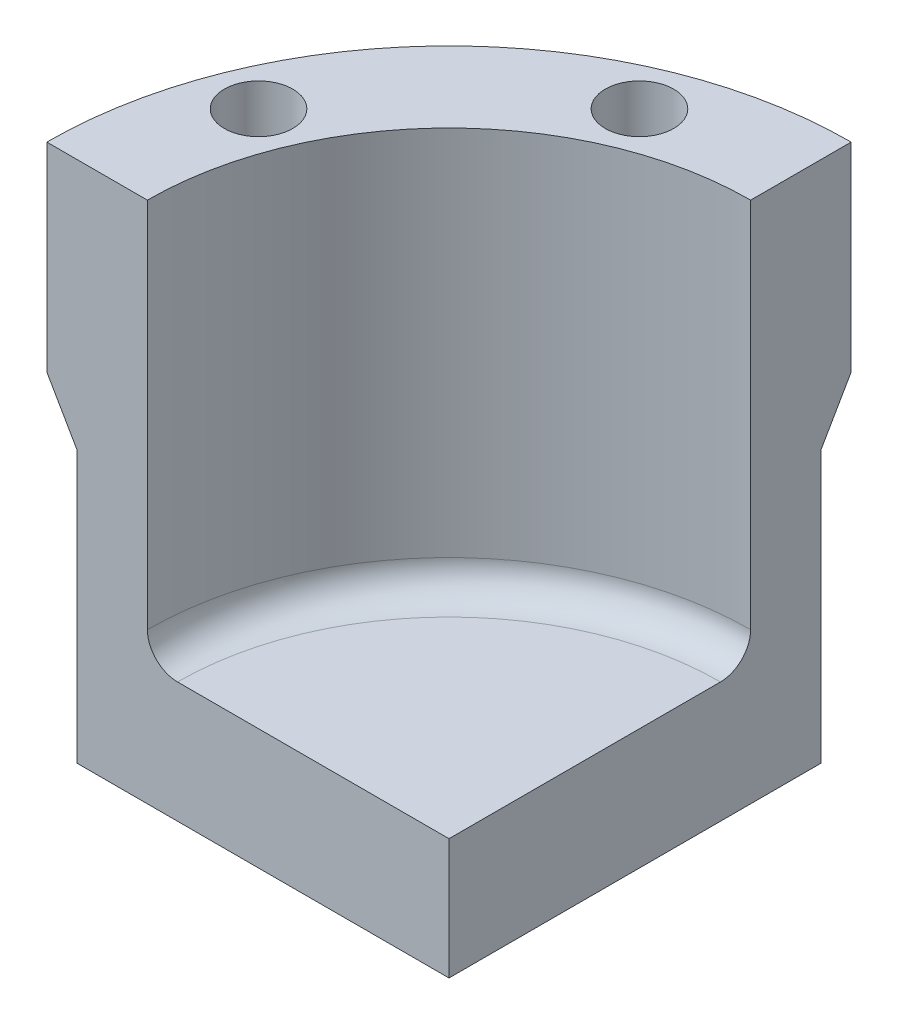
SolidWorks part; units mm, degrees
ref_plane "Ebene vorne" through (0, 0, 0) normal (0, 0, 1) x (1, 0, 0)
ref_plane "Ebene oben" through (0, 0, 0) normal (0, 1, 0) x (1, 0, 0)
ref_plane "Ebene rechts" through (0, 0, 0) normal (1, 0, 0) x (0, 0, -1)
sketch "Skizze1" plane through (0, 0, 0) normal (0, 0, 1) x (1, 0, 0)
  line L0 (0, 0) -> (-30, 0)
  line L1 (55, 0) -> (-55, 0) construction
  line L2 (-30, 0) -> (-30, 40)
  line L3 (-30, 40) -> (-40, 40)
  line L4 (-40, 40) -> (-40, 20.1962)
  line L5 (-40, 20.1962) -> (-37, 15)
  line L6 (-37, 15) -> (-37, -12)
  line L7 (-37, -12) -> (0, -12)
  line L8 (0, -55) -> (0, 55) construction
  line L9 (0, -12) -> (0, 0)
  line L10 (0, 25.4814) -> (0, -34.0079) construction
  dimension "D1" = 60
  dimension "D2" = 12
  dimension "D3" = 74
  dimension "D4" = 80
  dimension "D5" = 15
  dimension "D6" = 40
  dimension "D7" = 30
revolve "Rotation1" add sketch "Skizze1" angle 90 about L10
hole_wizard "M8 Gewindebohrung1" positions "Skizze3" profile "Skizze2" tap size "M8" standard "ISO"
sketch "Skizze3" plane through (0, 40, 0) normal (0, 1, 0) x (1, 0, 0)
  line L0 (0, 0) -> (-32.3358, 13.3939) construction
  line L2 (0, 0) -> (-13.3939, 32.3358) construction
  line L4 (0, 0) -> (-30, 0) construction
  point P0 (-32.3358, 13.3939)
  point P2 (-13.3939, 32.3358)
  dimension "D1" = 45
  dimension "D2" = 22.5
  dimension "D3" = 35
sketch "Skizze2" plane through (-32.3358, 40, -13.3939) normal (1, 0, 0) x (0, 0, 1)
  line L0 (0, 0) -> (0, 24.2929)
  line L1 (0, 24.2929) -> (3.4, 22.25)
  line L2 (3.4, 22.25) -> (3.4, 0)
  line L5 (3.4, 0) -> (0, 0)
  line L10 (0, 24.2929) -> (-3.4, 22.25) construction
  line L11 (0, -6.35) -> (0, 107.95) construction
  dimension "Bohrerdurchmesser" = 6.8
  dimension "Bohrungstiefe" = 22.25
  dimension "Spitzenwinkel" = 118
fillet "Verrundung1" radius 3 1 edges at (-21.2132, 0, -21.2132)
